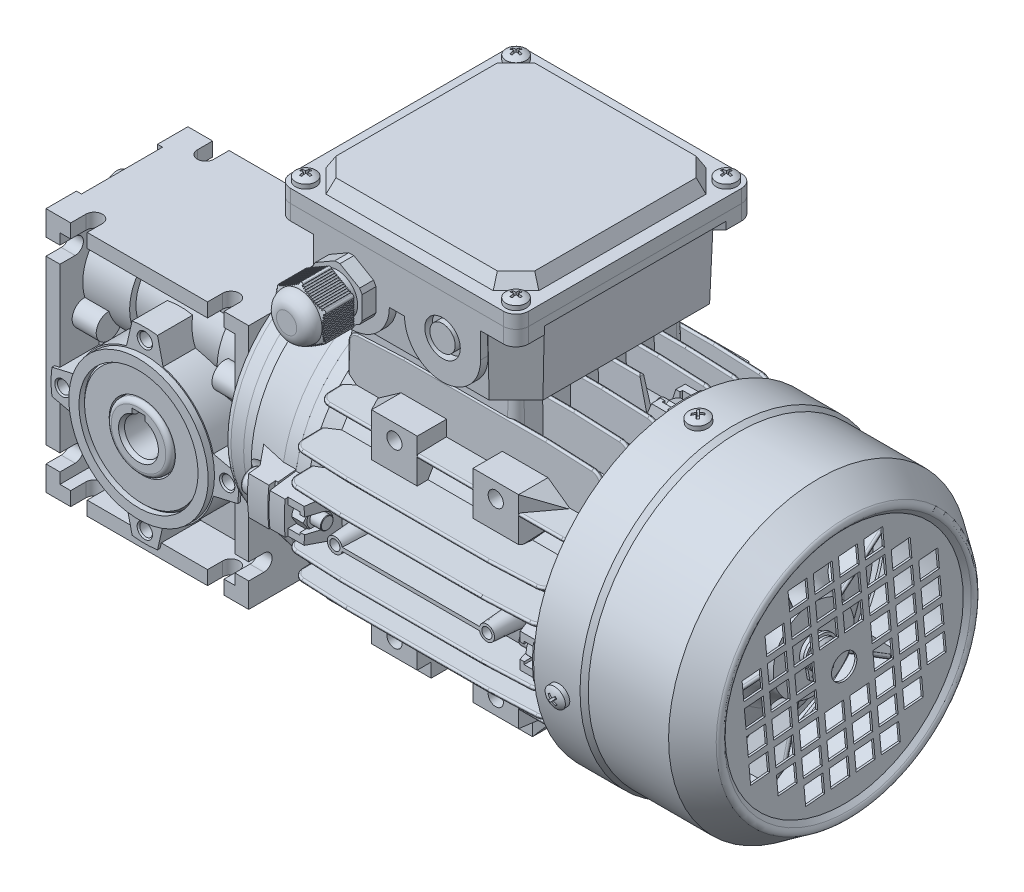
SolidWorks part; units mm, degrees
other "SB030_63B14-1/SB030-50worm shaft-1-solid body1"
other "SB030_63B14-1/SB30casing-1-solid body1"
other "SB030_63B14-1/SB030input flange-1-solid body1"
other "SB030_63B14-1/SB030-50worm wheel-1-solid body1"
other "SB030_63B14-1/RSC_02504707-1-solid body1"
other "SB030_63B14-1/RSC_02504707-2-solid body1"
other "MS63-B14 0.18kW 1310 rpm  50003-1/Hexagon socket head cap screws GB_GB_FASTENER_SCREWS_HSHCS M5X25-N_1-1-solid body1"
other "MS63-B14 0.18kW 1310 rpm  50003-1/Circlips for shaft--Type A large GB_GB_CONNECTING_PIECE_RING_RRA 11_1-1-solid body1"
other "MS63-B14 0.18kW 1310 rpm  50003-1/Cross recessed thread forming screws GB_GB_CROSS_SCREWS_TYPE138 M4X10-N_1-1-solid body1"
other "MS63-B14 0.18kW 1310 rpm  50003-1/63 ºó¸Ç_Ä¬ÈÏ_1-1-solid body1"
other "MS63-B14 0.18kW 1310 rpm  50003-1/Cross recessed thread forming screws GB_GB_CROSS_SCREWS_TYPE138 M4X10-N_1-2-solid body1"
other "MS63-B14 0.18kW 1310 rpm  50003-1/Hexagon socket head cap screws GB_GB_FASTENER_SCREWS_HSHCS M5X25-N_1-2-solid body1"
other "MS63-B14 0.18kW 1310 rpm  50003-1/Hexagon socket head cap screws GB_GB_FASTENER_SCREWS_HSHCS M5X25-N_1-3-solid body1"
other "MS63-B14 0.18kW 1310 rpm  50003-1/Hexagon socket head cap screws GB_GB_FASTENER_SCREWS_HSHCS M5X25-N_1-4-solid body1"
other "MS63-B14 0.18kW 1310 rpm  50003-1/Hexagon socket head cap screws GB_GB_FASTENER_SCREWS_HSHCS M5X25-N_1-5-solid body1"
other "MS63-B14 0.18kW 1310 rpm  50003-1/Hexagon nuts grade C GB_GB_FASTENER_NUT_SNC1 M5-N_1-1-solid body1"
other "MS63-B14 0.18kW 1310 rpm  50003-1/63 ·çÕÖ_Ä¬ÈÏ_1-1-solid body1"
other "MS63-B14 0.18kW 1310 rpm  50003-1/Cross recessed thread forming screws GB_GB_CROSS_SCREWS_TYPE138 M4X10-N_1-3-solid body1"
other "MS63-B14 0.18kW 1310 rpm  50003-1/Hexagon socket head cap screws GB_GB_FASTENER_SCREWS_HSHCS M5X25-N_1-6-solid body1"
other "MS63-B14 0.18kW 1310 rpm  50003-1/63»ú¿Ç_Ä¬ÈÏ_1-1-solid body1"
other "MS63-B14 0.18kW 1310 rpm  50003-1/Hexagon nuts grade C GB_GB_FASTENER_NUT_SNC1 M5-N_1-2-solid body1"
other "MS63-B14 0.18kW 1310 rpm  50003-1/Hexagon nuts grade C GB_GB_FASTENER_NUT_SNC1 M5-N_1-3-solid body1"
other "MS63-B14 0.18kW 1310 rpm  50003-1/MS63-71 ÐÂ½ÓÏßºÐ¸Ç_Ä¬ÈÏ_1-1-solid body1"
other "MS63-B14 0.18kW 1310 rpm  50003-1/Cross recessed thread forming screws GB_GB_CROSS_SCREWS_TYPE138 M4X10-N_1-4-solid body1"
other "MS63-B14 0.18kW 1310 rpm  50003-1/Hexagon nuts grade C GB_GB_FASTENER_NUT_SNC1 M5-N_1-4-solid body1"
other "MS63-B14 0.18kW 1310 rpm  50003-1/MS63-71 ÐÂ½ÓÏßºÐ×ù_Ä¬ÈÏ_1-1-solid body1"
other "MS63-B14 0.18kW 1310 rpm  50003-1/Hexagon nuts grade C GB_GB_FASTENER_NUT_SNC1 M5-N_1-5-solid body1"
other "MS63-B14 0.18kW 1310 rpm  50003-1/Hexagon socket head cap screws GB_GB_FASTENER_SCREWS_HSHCS M5X25-N_1-7-solid body1"
other "MS63-B14 0.18kW 1310 rpm  50003-1/Hexagon nuts grade C GB_GB_FASTENER_NUT_SNC1 M5-N_1-6-solid body1"
other "MS63-B14 0.18kW 1310 rpm  50003-1/63 ×ªÖá_Ä¬ÈÏ_1-1-solid body1"
other "MS63-B14 0.18kW 1310 rpm  50003-1/Hexagon nuts grade C GB_GB_FASTENER_NUT_SNC1 M5-N_1-7-solid body1"
other "MS63-B14 0.18kW 1310 rpm  50003-1/Hexagon nuts grade C GB_GB_FASTENER_NUT_SNC1 M5-N_1-8-solid body1"
other "MS63-B14 0.18kW 1310 rpm  50003-1/63 B14¸Ç_Ä¬ÈÏ_1-1-solid body1"
other "MS63-B14 0.18kW 1310 rpm  50003-1/MS63 ·çÒ¶_Ä¬ÈÏ_1-1-solid body1"
other "MS63-B14 0.18kW 1310 rpm  50003-1/³öÏßÂÝÌ×M16_Ä¬ÈÏ_1-1-solid body1"
other "MS63-B14 0.18kW 1310 rpm  50003-1/Cross recessed thread forming screws GB_GB_CROSS_SCREWS_TYPE138 M4X10-N_1-5-solid body1"
other "MS63-B14 0.18kW 1310 rpm  50003-1/Cross recessed thread forming screws GB_GB_CROSS_SCREWS_TYPE138 M4X10-N_1-6-solid body1"
other "MS63-B14 0.18kW 1310 rpm  50003-1/Cross recessed thread forming screws GB_GB_CROSS_SCREWS_TYPE138 M4X10-N_1-7-solid body1"
other "MS63-B14 0.18kW 1310 rpm  50003-1/Cross recessed thread forming screws GB_GB_CROSS_SCREWS_TYPE138 M4X10-N_1-8-solid body1"
other "MS63-B14 0.18kW 1310 rpm  50003-1/Hexagon socket head cap screws GB_GB_FASTENER_SCREWS_HSHCS M5X25-N_1-8-solid body1"
ref_plane "Front Plane" through (0, 0, 0) normal (0, 0, 1) x (1, 0, 0)
ref_plane "Top Plane" through (0, 0, 0) normal (0, 1, 0) x (1, 0, 0)
ref_plane "Right Plane" through (0, 0, 0) normal (1, 0, 0) x (0, 0, -1)
other "Make MultiBody Part1"
